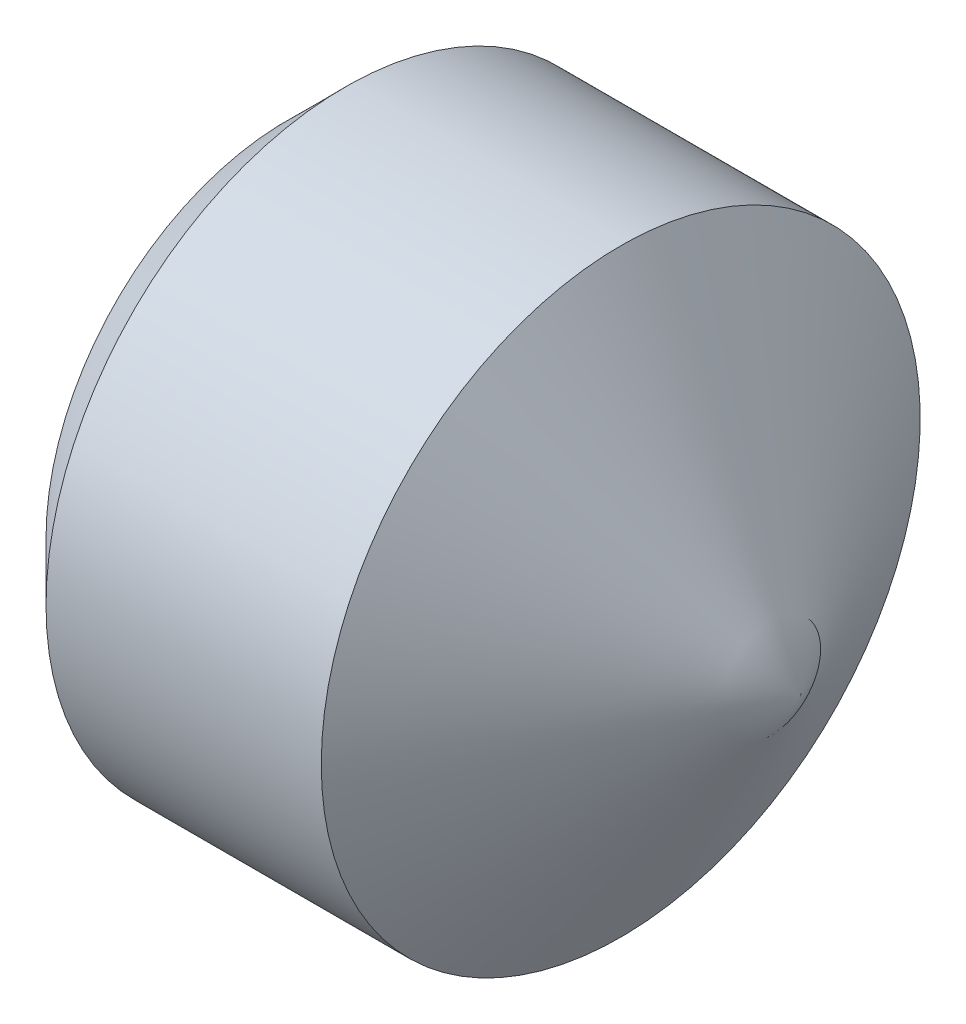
SolidWorks part; units mm, degrees
ref_plane "Plane1" through (0, 0, 0) normal (0, 0, 1) x (1, 0, 0)
ref_plane "Plane2" through (0, 0, 0) normal (0, 1, 0) x (1, 0, 0)
ref_plane "Plane3" through (0, 0, 0) normal (1, 0, 0) x (0, 0, -1)
sketch "BodySke" plane through (0, 0, 0) normal (0, 0, 1) x (1, 0, 0)
  line L0 (0, 0) -> (0, 4.4768)
  line L1 (0, 4.4768) -> (1.0795, 5.5562)
  line L2 (1.0795, 5.5562) -> (6.1865, 5.5562)
  line L3 (6.1865, 5.5562) -> (9.525, 0)
  line L4 (9.525, 0) -> (0, 0)
  line L5 (-12.7, 0) -> (88.9, 0) construction
  line L6 (6.1865, -5.5562) -> (9.525, 0) construction
  line L7 (0.9068, 15.875) -> (0.9068, -3.175) construction
  line L8 (0, -4.4768) -> (1.0795, -5.5562) construction
  dimension "Cone_ang" = 118
  dimension "Length" = 9.525
  dimension "Diameter" = 11.1125
  dimension "Drive_ch_ang" = 45
  dimension "Minor_dia" = 8.9535
  dimension "Advance" = 1.8136
revolve "BaseBody" add sketch "BodySke" angle 360 about L5
sketch "Sketch2" plane through (0, 0, 0) normal (-1, 0, 0) x (0, 0, 1)
  line L0 (1.6036, 2.7775) -> (-1.6036, 2.7775)
  line L1 (-1.6036, 2.7775) -> (-3.2072, 0)
  line L2 (1.6036, 2.7775) -> (3.2072, 0)
  line L3 (1.6036, -2.7775) -> (3.2072, 0)
  line L4 (1.6036, -2.7775) -> (-1.6036, -2.7775)
  line L5 (-1.6036, -2.7775) -> (-3.2072, 0)
  dimension "Hex_size" = 5.555
  dimension "D2" = 2.7775
  dimension "D3" = 2.7775
extrude "Hex" cut sketch "Sketch2" against normal blind 5.5626
sketch "Sketch4" plane through (0, 4.7709, -0.5249) normal (-1, 0, 0) x (0, 0, 1)
  line L0 (0.5249, -4.7709) -> (3.7761, -4.7709)
  line L1 (0.5249, -4.7709) -> (6.6732, -1.2211) construction
  line L2 (0.5249, -4.7709) -> (2.1505, -1.9553)
  line L3 (3.2453, -4.0801) -> (3.6431, -3.8505)
  line L4 (2.4833, -2.7603) -> (2.8811, -2.5306)
  arc A0 (3.2453, -4.0801) -> (2.4833, -2.7603) centre (0.5249, -4.7709) ccw
  arc A1 (3.7761, -4.7709) -> (3.6431, -3.8505) centre (0.5249, -4.7709) ccw
  arc A2 (2.1505, -1.9553) -> (2.8811, -2.5306) centre (0.5249, -4.7709) cw
  circle A3 centre (0.5249, -4.7709) radius 2.8067 construction
  circle A4 centre (0.5249, -4.7709) radius 3.2512 construction
  dimension "D1" = 30
  dimension "Spline_n_dim" = 5.6134
  dimension "Spline_m_dim" = 6.5024
  dimension "Spline_a_dim" = 60
  dimension "D3" = 0.762
  dimension "Spline_p_dim" = 1.524
extrude "Spline" [suppressed] cut sketch "Sketch4" against normal blind 5.5626
pattern_circular "CirPattern1" [suppressed] count 6 every 60 about axis through (-12.7, 0, 0) along (1, 0, 0)
sketch "ThdSchSke" plane through (0, 0, 0) normal (0, 0, 1) x (1, 0, 0)
  line L0 (1.0795, -4.4768) -> (0.3236, -5.5563)
  line L1 (1.0795, -4.4768) -> (1.8354, -5.5563)
  line L2 (1.8354, -5.5563) -> (1.8354, -6.9453)
  line L3 (-3.175, 0) -> (5.1513, 0) construction
  line L4 (1.0795, 5.5562) -> (1.0795, -5.5562) construction
  line L5 (1.8354, -6.9453) -> (0.3236, -6.9453)
  line L6 (0.3236, -6.9453) -> (0.3236, -5.5563)
  dimension "Thread_minor" = 8.9535
  dimension "Diameter" = 11.1125
  dimension "SideAngle" = 55
  dimension "VeeAngle" = 70
  dimension "Overcut" = 13.8906
revolve "ThreadSchematic" [suppressed] cut sketch "ThdSchSke" angle 360 about L3
pattern_linear "ThdSchPat" [suppressed]
equation "\"D2@Sketch2\" = \"Hex_size@Sketch2\" / 2"
equation "\"D3@Sketch2\" = \"Hex_size@Sketch2\" / 2"
equation "\"Thread_minor@ThreadCosmetic\" = \"Minor_dia@BodySke\""
equation "\"D1@Sketch4\" = \"Spline_a_dim@Sketch4\" / 2"
equation "\"D3@Sketch4\" = \"Spline_p_dim@Sketch4\" / 2"
equation "\"D2@CirPattern1\" = \"Spline_a_dim@Sketch4\""
equation "\"Num_teeth@CirPattern1\" = 360 / \"D2@CirPattern1\""
equation "\"Thread_minor@ThdSchSke\" = \"Thread_minor@ThreadCosmetic\""
equation "\"Diameter@ThdSchSke\" = \"Diameter@BodySke\""
equation "\"Overcut@ThdSchSke\" = \"Diameter@BodySke\" * 1.25"
equation "\"Num_threads@ThdSchPat\" = int( (\"Length@BodySke\" - ( ( ( \"Diameter@BodySke\" - \"Minor_dia@BodySke\" ) * 0.5 ) / tan( \"Drive_ch_ang@BodySke\" * 0.017453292 ) ) - ( ( \"Diameter@BodySke\" * 0.5 ) / tan( \"Con"
equation "\"Advance@ThdSchPat\" = (\"Length@BodySke\" - ( ( ( \"Diameter@BodySke\" - \"Minor_dia@BodySke\" ) * 0.5 ) / tan( \"Drive_ch_ang@BodySke\" * 0.017453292 ) ) - ( ( \"Diameter@BodySke\" * 0.5 ) / tan( \"Cone_ang@Bod"
equation "' \"Num_threads@ThdSchPat\" = \"Num_threads@ThdSchPat\" - sgn( \"Num_threads@ThdSchPat\" - 1) '---chamfered tips only---"
